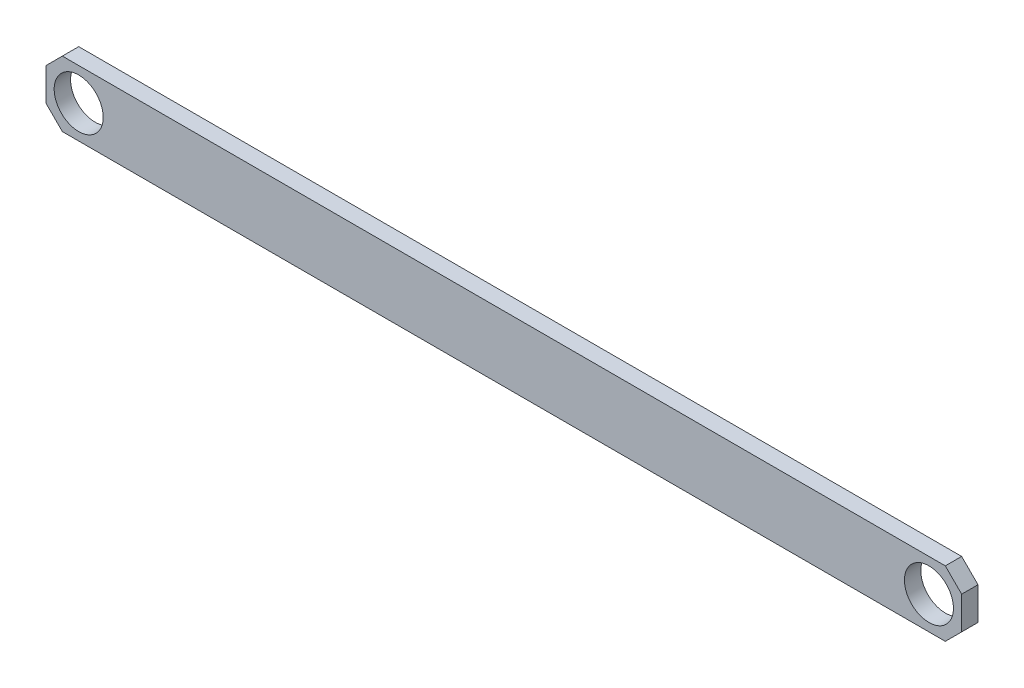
SolidWorks part; units mm, degrees
ref_plane "Front" through (0, 0, 0) normal (0, 0, 1) x (1, 0, 0)
ref_plane "Top" through (0, 0, 0) normal (0, 1, 0) x (1, 0, 0)
ref_plane "Right" through (0, 0, 0) normal (1, 0, 0) x (0, 0, -1)
sketch "Sketch1" plane through (0, 0, 0) normal (0, 0, 1) x (1, 0, 0)
  line L0 (0, 6.35) -> (27.8068, 6.35) construction
  line L1 (0, 0) -> (177.8, 0)
  line L2 (0, 0) -> (0, 12.7)
  line L3 (0, 12.7) -> (177.8, 12.7)
  line L4 (177.8, 0) -> (177.8, 12.7)
  line L5 (88.9, 0) -> (88.9, -44.6153) construction
  circle A0 centre (6.35, 6.35) radius 4.7625
  circle A1 centre (171.45, 6.35) radius 4.7625
  dimension "D3" = 9.525
  dimension "D4" = 6.35
  dimension "D1" = 12.7
  dimension "D2" = 177.8
extrude "Base-Extrude" add sketch "Sketch1" along normal blind 3.175
chamfer "Chamfer1" distance 3.175 angle 45 4 edges at (0, 12.7, 1.5875) (177.8, 12.7, 1.5875) (177.8, 0, 1.5875) (0, 0, 1.5875)
